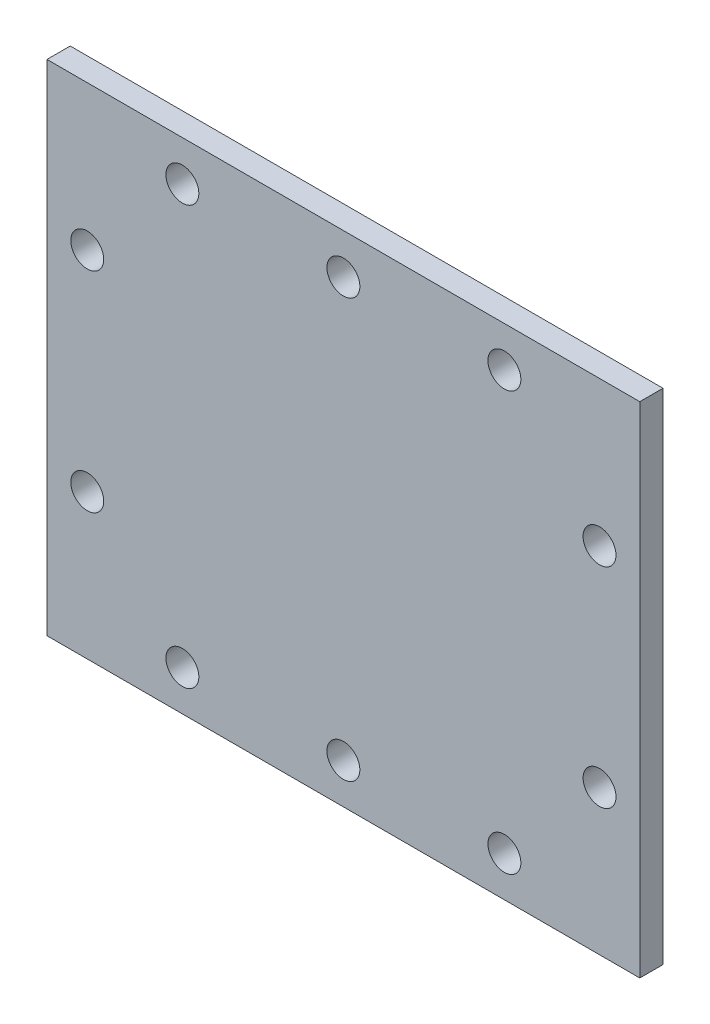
SolidWorks part; units mm, degrees
other "Title Block Table1"
other "DetailItem18"
other "DetailItem19"
other "DetailItem22"
ref_plane "Top Plane" through (0, 0, 0) normal (0, 0, 1) x (1, 0, 0)
ref_plane "Right Plane" through (0, 0, 0) normal (0, 1, 0) x (1, 0, 0)
ref_plane "Front Plane" through (0, 0, 0) normal (1, 0, 0) x (0, 0, -1)
sketch "Sketch1" plane through (0, 0, 0) normal (0, 0, 1) x (1, 0, 0)
  line L1 (0, 0) -> (81, 0)
  line L2 (0, 0) -> (0, 68.2)
  line L3 (0, 68.2) -> (81, 68.2)
  line L4 (81, 0) -> (81, 68.2)
  dimension "D1" = 81
  dimension "D2" = 68.2
extrude "Window, Polycarbonate" add sketch "Sketch1" along normal blind 3.175
hole_wizard "10X, Clearance Hole, M4" positions "Sketch2" profile "Sketch3" hole size "M4" standard "ANSI Metric"
sketch "Sketch2" plane through (0, 0, 3.175) normal (0, 0, 1) x (1, 0, 0)
  line L1 (5.5, 62.7) -> (75.5, 62.7) construction
  line L2 (5.5, 62.7) -> (5.5, 5.5) construction
  line L3 (5.5, 5.5) -> (75.5, 5.5) construction
  line L4 (75.5, 62.7) -> (75.5, 5.5) construction
  line L5 (81, 0) -> (81, 68.2) construction
  line L7 (5.5, 34.1) -> (75.5, 34.1) construction
  line L8 (81, 68.2) -> (0, 68.2) construction
  circle A0 centre (18.5, 62.7) radius 5.5 construction
  circle A1 centre (18.5, 5.5) radius 5.5 construction
  circle A2 centre (5.5, 48.4) radius 5.5 construction
  circle A3 centre (75.5, 48.4) radius 5.5 construction
  point P0 (40.5, 5.5)
  point P2 (62.5, 5.5)
  point P4 (18.5, 5.5)
  point P6 (5.5, 19.8)
  point P8 (5.5, 48.4)
  point P10 (18.5, 62.7)
  point P12 (62.5, 62.7)
  point P14 (75.5, 48.4)
  point P16 (75.5, 19.8)
  point P118 (75.5, 34.1)
  point P121 (81, 34.1)
  point P144 (-14.097, 58.7175)
  point P146 (40.5, 62.7)
  point P148 (-22.0975, 69.695)
  point P154 (40.5, 62.7)
  point P156 (40.5, 5.5)
  point P174 (40.5, 68.2)
sketch "Sketch3" plane through (40.5, 5.5, 3.175) normal (1, 0, 0) x (0, -1, 0)
  line L0 (0, 0) -> (0, 3.175)
  line L1 (0, 3.175) -> (2.25, 3.175)
  line L2 (2.25, 3.175) -> (2.25, 0)
  line L5 (2.25, 0) -> (0, 0)
  line L11 (0, -6.35) -> (0, 107.95) construction
  dimension "Thru Hole Dia." = 4.5
  dimension "Thru Hole Depth" = 3.175
equation "\"D5@Sketch2\"=\"D4@Sketch2\""
equation "\"D7@Sketch2\"=\"D6@Sketch2\"/2"
